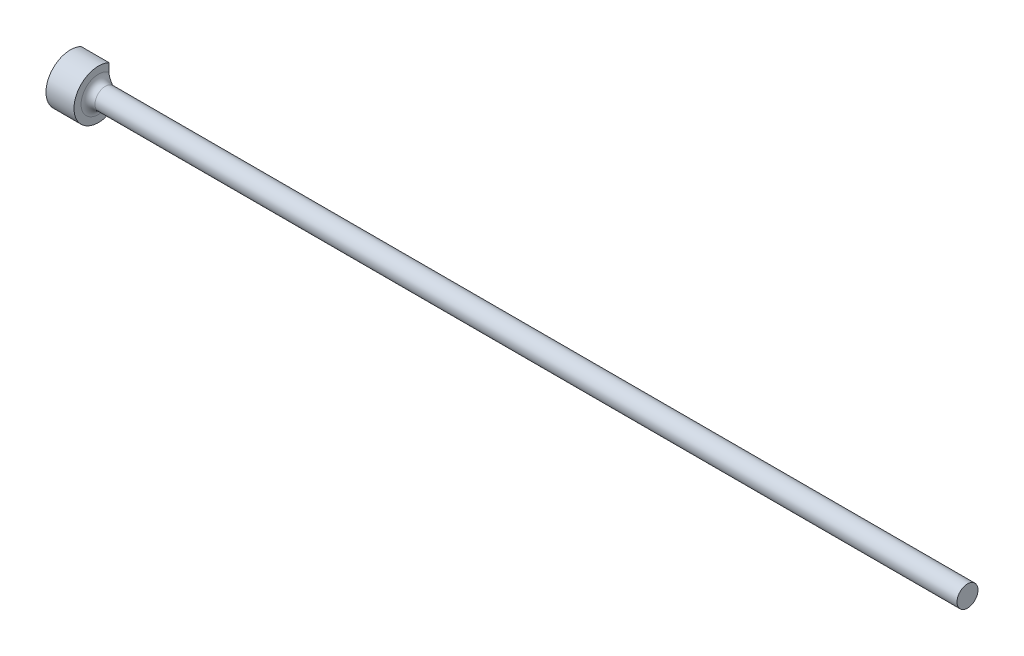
SolidWorks part; units mm, degrees
ref_plane "Front Plane" through (0, 0, 0) normal (0, 0, 1) x (1, 0, 0)
ref_plane "Top Plane" through (0, 0, 0) normal (0, 1, 0) x (1, 0, 0)
ref_plane "Right Plane" through (0, 0, 0) normal (1, 0, 0) x (0, 0, -1)
sketch "Sketch1" plane through (0, 0, 0) normal (0, 0, 1) x (1, 0, 0)
  line L0 (0, 0) -> (0, 2.7781)
  line L1 (0, 2.7781) -> (3.175, 2.7781)
  line L2 (3.175, 2.7781) -> (3.175, 1.978)
  line L3 (3.9624, 1.1906) -> (101.6, 1.1906)
  line L4 (101.6, 1.1906) -> (101.6, 0)
  line L5 (101.6, 0) -> (0, 0)
  line L6 (101.6, 0) -> (0, 0) construction
  line L7 (0, 0) -> (-10.4771, 0) construction
  line L8 (101.6, 0) -> (1002.3976, 0) construction
  line L9 (3.9624, 1.1906) -> (-7.9138, 1.1906) construction
  arc A0 (3.9624, 1.1906) -> (3.175, 1.978) centre (3.9624, 1.978) cw
  dimension "D1" = 0.7874
  dimension "HeadDia" = 5.5562
  dimension "HeadThickness" = 3.175
  dimension "PinDia" = 2.3813
  dimension "overall" = 101.6
revolve "PIN" add sketch "Sketch1" angle 360 about L6
ref_plane "Plane1" through (52.7812, 0, -1.1906) normal (0, 0, -1) x (0, -1, 0)
ref_plane "CutPlane" through (0, 0, -1.1909) normal (0, 0, -1) x (-1, 0, 0)
other "SurfaceCut1"
